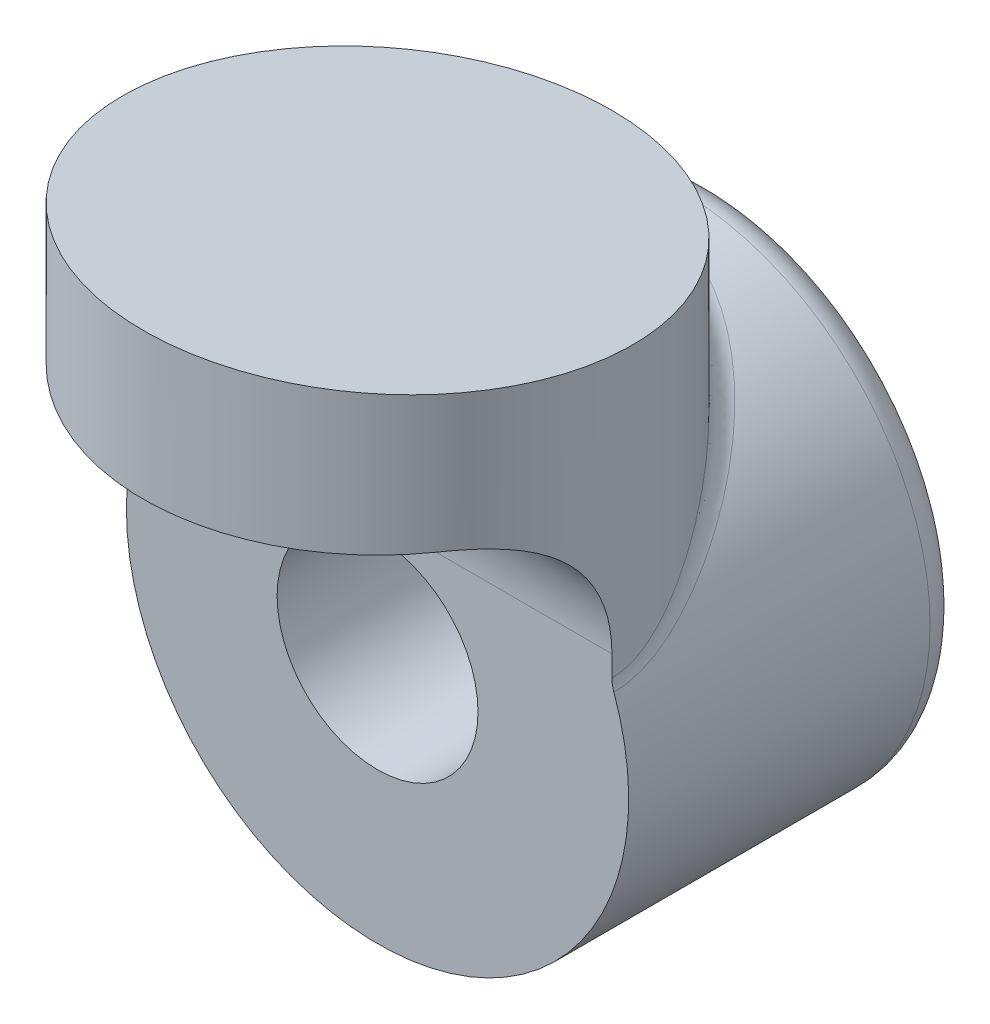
SolidWorks part; units mm, degrees
ref_plane "Plan de face" through (0, 0, 0) normal (0, 0, 1) x (1, 0, 0)
ref_plane "Plan de dessus" through (0, 0, 0) normal (0, 1, 0) x (1, 0, 0)
ref_plane "Plan de droite" through (0, 0, 0) normal (1, 0, 0) x (0, 0, -1)
sketch "Esquisse1" plane through (0, 0, 0) normal (0, 0, 1) x (1, 0, 0)
  circle A0 centre (0, 0) radius 6
  circle A1 centre (0, 0) radius 15
  dimension "D1" = 12
  dimension "D2" = 30
extrude "Extrusion1" add sketch "Esquisse1" along normal blind 25
ref_plane "Plan1" through (0, 0, 25) normal (0, 0, 1) x (1, 0, 0)
sketch "Esquisse2" plane through (0, 0, 25) normal (0, 0, 1) x (1, 0, 0)
  line L0 (0, 0) -> (0, 30.7214) construction
  line L2 (0, 25) -> (14, 25)
  line L3 (0, 25) -> (0, 5)
  line L4 (0, 5) -> (14, 5)
  line L5 (14, 25) -> (14, 5)
  dimension "D1" = 25
  dimension "D2" = 20
  dimension "D3" = 28
revolve "Révolution1" add sketch "Esquisse2" angle 360 about L0
sketch "Esquisse3" plane through (0, 0, 25) normal (0, 0, 1) x (1, 0, 0)
  line L1 (-20, 15) -> (20, 15)
  line L2 (-20, 15) -> (-20, 0)
  line L3 (-20, 0) -> (20, 0)
  line L4 (20, 15) -> (20, 0)
  arc A1 (-14, 5.3852) -> (14, 5.3852) centre (0, 0) ccw construction
  dimension "D1" = 20
  dimension "D2" = 40
  dimension "D3" = 15
extrude "Enlèv. mat.-Extru.1" cut sketch "Esquisse3" along normal blind 20
sketch "Esquisse4" plane through (0, 0, 25) normal (0, 0, 1) x (1, 0, 0)
  arc A0 (-3.3166, 5) -> (3.3166, 5) centre (0, 0) ccw construction
  circle A1 centre (0, 0) radius 6
extrude "Enlèv. mat.-Extru.2" cut sketch "Esquisse4" against normal through all
fillet "Congé1" radius 8 1 edges at (0, 15, 25)
fillet "Congé2" radius 2 1 edges at (0.9464, 14.9701, 11.032)
sketch "Esquisse5" plane through (0, 0, 0) normal (1, 0, 0) x (0, 0, -1)
  line L0 (-42.2044, 32.0592) -> (-42.9475, 24.0938)
  line L1 (-42.2044, 32.0592) -> (7.5794, 27.4145)
  line L2 (-42.9475, 24.0938) -> (6.8363, 19.449)
  line L3 (7.5794, 27.4145) -> (6.8363, 19.449)
  line L4 (-4.3851, 261.8495) -> (-26.9549, 19.9392) construction
  dimension "D1" = 20
  dimension "D2" = 8
  dimension "D3" = 5
  dimension "D4" = 50
extrude "Enlèv. mat.-Extru.3" cut sketch "Esquisse5" against normal mid plane 80
sketch "Esquisse6" plane through (0, 0, 0) normal (0, 0, -1) x (-1, 0, 0)
  circle A0 centre (0, 0) radius 15 construction
  circle A1 centre (0, 0) radius 15
extrude "Enlèv. mat.-Extru.4" cut sketch "Esquisse6" against normal blind 5
fillet "Congé3" radius 2 1 edges at (-15, 0, 5)
